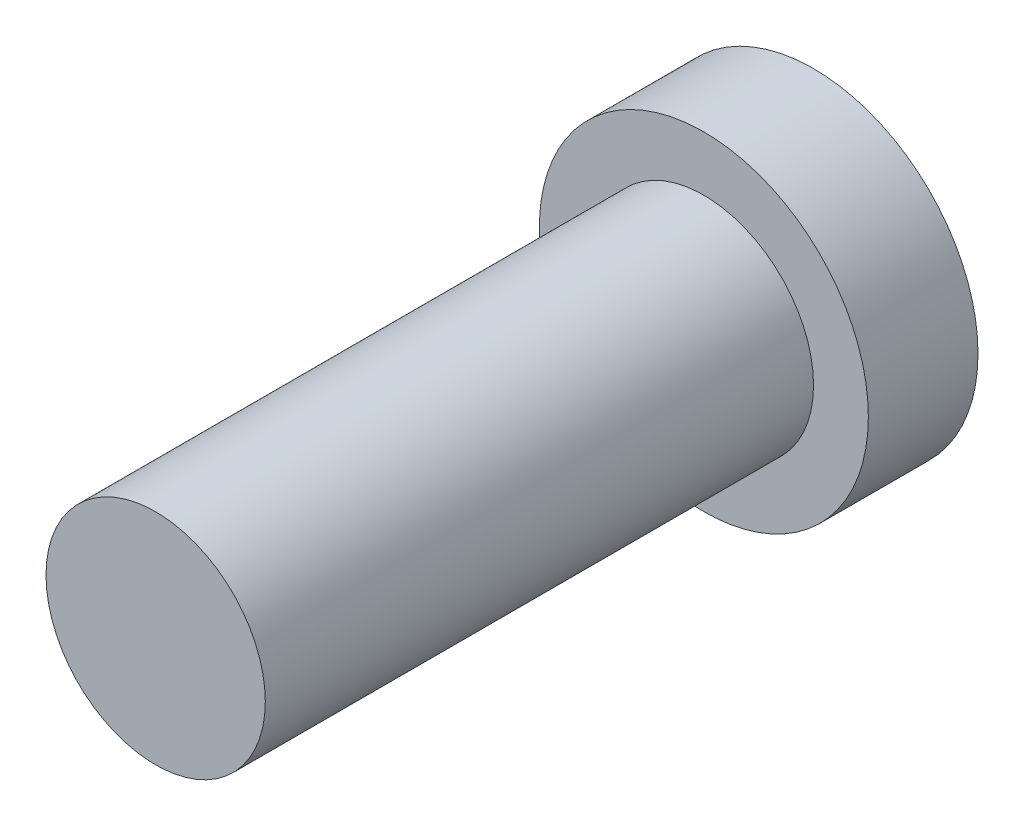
SolidWorks part; units mm, degrees
ref_plane "Front Plane" through (0, 0, 0) normal (0, 0, 1) x (1, 0, 0)
ref_plane "Top Plane" through (0, 0, 0) normal (0, 1, 0) x (1, 0, 0)
ref_plane "Right Plane" through (0, 0, 0) normal (1, 0, 0) x (0, 0, -1)
sketch "Sketch1" plane through (0, 0, 0) normal (0, 1, 0) x (1, 0, 0)
  line L0 (0, 0) -> (0, 60)
  line L1 (0, 60) -> (15, 60)
  line L2 (15, 60) -> (15, 50)
  line L3 (15, 50) -> (10, 50)
  line L4 (10, 50) -> (10, 0)
  line L5 (10, 0) -> (0, 0)
  dimension "D1" = 60
  dimension "D2" = 15
  dimension "D3" = 10
revolve "Revolve1" add sketch "Sketch1" angle 360 about L0
